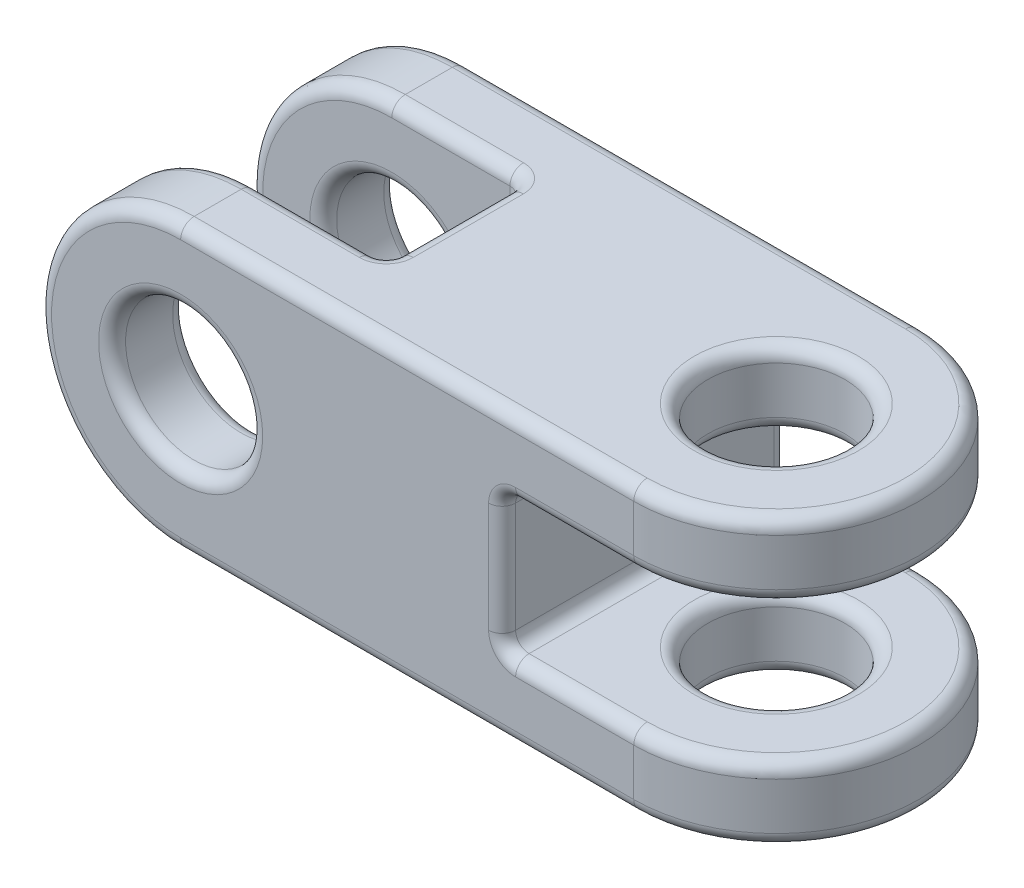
SolidWorks part; units mm, degrees
ref_plane "Front Plane" through (0, 0, 0) normal (0, 0, 1) x (1, 0, 0)
ref_plane "Top Plane" through (0, 0, 0) normal (0, 1, 0) x (1, 0, 0)
ref_plane "Right Plane" through (0, 0, 0) normal (1, 0, 0) x (0, 0, -1)
sketch "Sketch1" plane through (0, 0, 0) normal (0, 0, 1) x (1, 0, 0)
  line L0 (57.15, 8.5852) -> (-57.15, 8.5852) construction
  line L1 (0, 8.5852) -> (0, -8.5852) construction
  line L9 (0, -8.5852) -> (13.6398, -8.5852)
  line L10 (13.6398, -8.5852) -> (13.6398, 8.5852)
  line L11 (13.6398, 8.5852) -> (0, 8.5852)
  arc A0 (0, 8.5852) -> (0, -8.5852) centre (0, 0) ccw
  circle A1 centre (0, 0) radius 4.1275
  circle A2 centre (0, 0) radius 6.35 construction
  dimension "D3" = 8.255
  dimension "D2" = 13.6398
extrude "Extrude1" add sketch "Sketch1" along normal mid plane 17.1704
sketch "Sketch4" plane through (0, 8.5852, 0) normal (0, 1, 0) x (-1, 0, 0)
  line L0 (-7.9248, 0) -> (8.5852, 0) construction
  line L1 (8.5852, -4.1275) -> (8.5852, 4.1275)
  line L2 (-107.95, -34.0249) -> (6.35, -34.0249) construction
  line L3 (8.5852, -4.1275) -> (-7.9248, -4.1275)
  line L4 (8.5852, 4.1275) -> (-7.9248, 4.1275)
  line L5 (-7.9248, -4.1275) -> (-7.9248, 4.1275)
  line L6 (8.5852, -8.5852) -> (8.5852, 8.5852) construction
  point P8 (-13.6398, -60.0964)
  point P11 (-30.1498, 0)
  dimension "D1" = 8.255
  dimension "D2" = 16.51
  dimension "D3" = 29.8974
extrude "Cut-Extrude2" cut sketch "Sketch4" against normal through all
sketch "Sketch5" plane through (27.2796, 0, 0) normal (0, -1, 0) x (-1, 0, 0)
  line L1 (0, 8.5852) -> (0, -8.5852) construction
  line L9 (0, -8.5852) -> (13.6398, -8.5852)
  line L10 (13.6398, -8.5852) -> (13.6398, 8.5852)
  line L11 (13.6398, 8.5852) -> (0, 8.5852)
  arc A0 (0, 8.5852) -> (0, -8.5852) centre (0, 0) ccw
  circle A1 centre (0, 0) radius 4.1275
  dimension "D2" = 8.5852
extrude "Extrude2" add sketch "Sketch5" against normal mid plane 17.1704
sketch "Sketch7" plane through (27.94, 0, 0) normal (0, 0, -1) x (-1, 0, 0)
  line L0 (-7.9248, 0) -> (8.5852, 0) construction
  line L1 (8.5852, -4.1275) -> (8.5852, 4.1275)
  line L2 (-7.9248, 8.5852) -> (-7.9248, -8.5852) construction
  line L3 (8.5852, -4.1275) -> (-7.9248, -4.1275)
  line L4 (8.5852, 4.1275) -> (-7.9248, 4.1275)
  line L5 (-7.9248, -4.1275) -> (-7.9248, 4.1275)
  point P8 (-13.6398, -60.0964)
  point P11 (-30.1498, 0)
extrude "Cut-Extrude4" cut sketch "Sketch7" against normal through all and the other way through all
fillet "Fillet4" radius 0.8128 36 edges at (19.3548, -4.1275, 0) (19.3548, 4.1275, 0) (23.1521, 4.1275, 0) (35.8648, 4.1275, 0) (31.4071, -4.1275, 0) (35.8648, -4.1275, 0) (27.2796, -8.5852, -4.1275) (27.2796, 8.5852, -4.1275) (35.8648, 8.5852, 0) (35.8648, -8.5852, 0) (3.9624, 8.5852, -4.1275) (3.9624, 8.5852, 4.1275) (7.9248, 8.5852, 0) (3.9624, -8.5852, -4.1275) (3.9624, -8.5852, 4.1275) (7.9248, -8.5852, 0) (7.9248, 0, 4.1275) (7.9248, 0, -4.1275) (4.1275, 0, 4.1275) (-8.5852, 0, 4.1275) (-4.1275, 0, -4.1275) (-8.5852, 0, -4.1275) (4.1275, 0, -8.5852) (4.1275, 0, 8.5852) (-8.5852, 0, -8.5852) (13.6398, -8.5852, -8.5852) (13.6398, 8.5852, -8.5852) (-8.5852, 0, 8.5852) (13.6398, -8.5852, 8.5852) (13.6398, 8.5852, 8.5852) (19.3548, 0, 8.5852) (19.3548, 0, -8.5852) (23.3172, 4.1275, -8.5852) (23.3172, 4.1275, 8.5852) (23.3172, -4.1275, 8.5852) (23.3172, -4.1275, -8.5852)
